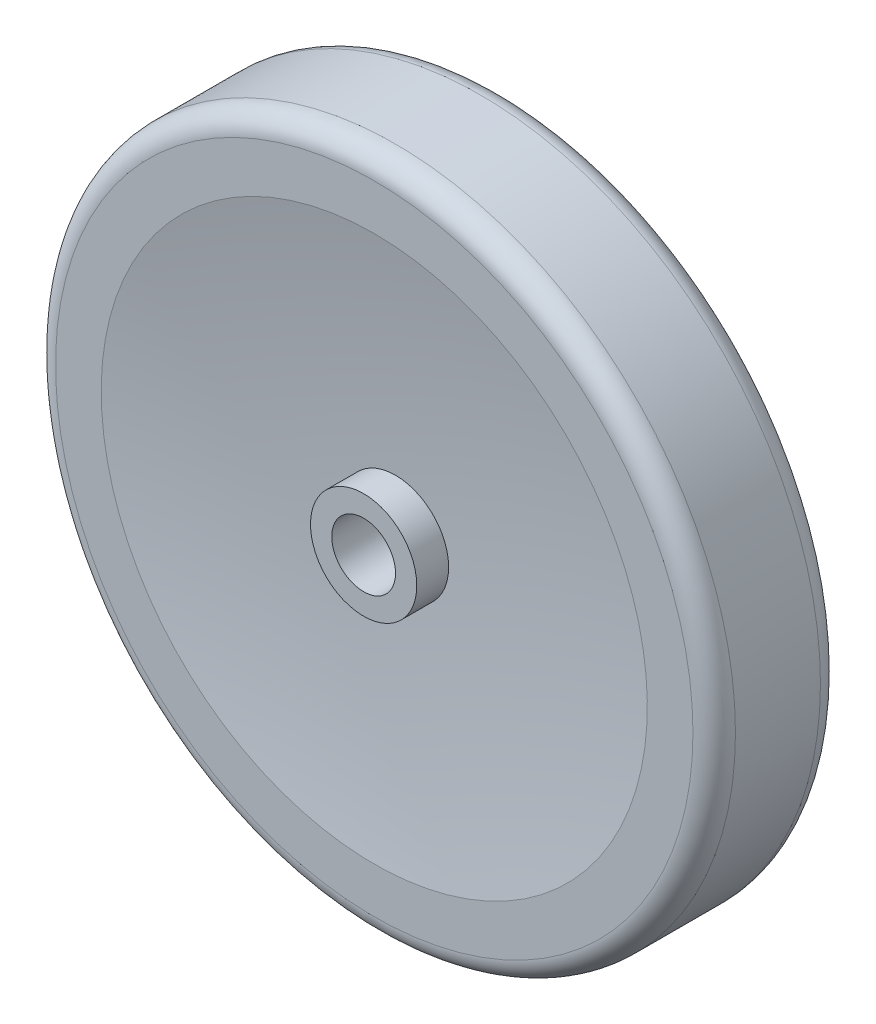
SolidWorks part; units mm, degrees
ref_plane "Front Plane" through (0, 0, 0) normal (0, 0, 1) x (1, 0, 0)
ref_plane "Top Plane" through (0, 0, 0) normal (0, 1, 0) x (1, 0, 0)
ref_plane "Right Plane" through (0, 0, 0) normal (1, 0, 0) x (0, 0, -1)
sketch "Sketch1" plane through (0, 0, 0) normal (1, 0, 0) x (0, 0, -1)
  line L0 (-26.7186, 0) -> (26.7186, 0) construction
  line L1 (0, 58.0175) -> (0, -46.7193) construction
  line L2 (6.35, 50.8) -> (-6.35, 50.8)
  line L3 (-9.525, 47.625) -> (-9.525, 40.8048)
  line L4 (9.525, 47.625) -> (9.525, 40.8048)
  line L6 (11.1125, 4.7625) -> (-11.1125, 4.7625)
  line L7 (-11.1125, 4.7625) -> (-11.1125, 7.9375)
  line L8 (-11.1125, 7.9375) -> (-6.35, 7.9375)
  line L9 (11.1125, 7.9375) -> (6.35, 7.9375)
  line L10 (11.1125, 4.7625) -> (11.1125, 7.9375)
  arc A0 (-9.525, 40.8048) -> (-6.35, 7.9375) centre (-260.2259, 0) cw
  arc A1 (9.525, 40.8048) -> (6.35, 7.9375) centre (260.2259, 0) ccw
  arc A2 (-6.35, 50.8) -> (-9.525, 47.625) centre (-6.35, 47.625) ccw
  arc A3 (9.525, 47.625) -> (6.35, 50.8) centre (6.35, 47.625) ccw
  point P8 (0, 50.8)
  point P16 (-9.525, 50.8)
  point P19 (9.525, 50.8)
  dimension "D3" = 254
  dimension "D6" = 3.175
  dimension "D1" = 22.225
  dimension "D2" = 101.6
  dimension "D4" = 19.05
  dimension "D5" = 9.525
  dimension "D7" = 15.875
  dimension "D8" = 12.7
revolve "Revolve1" add sketch "Sketch1" angle 360 about L0
